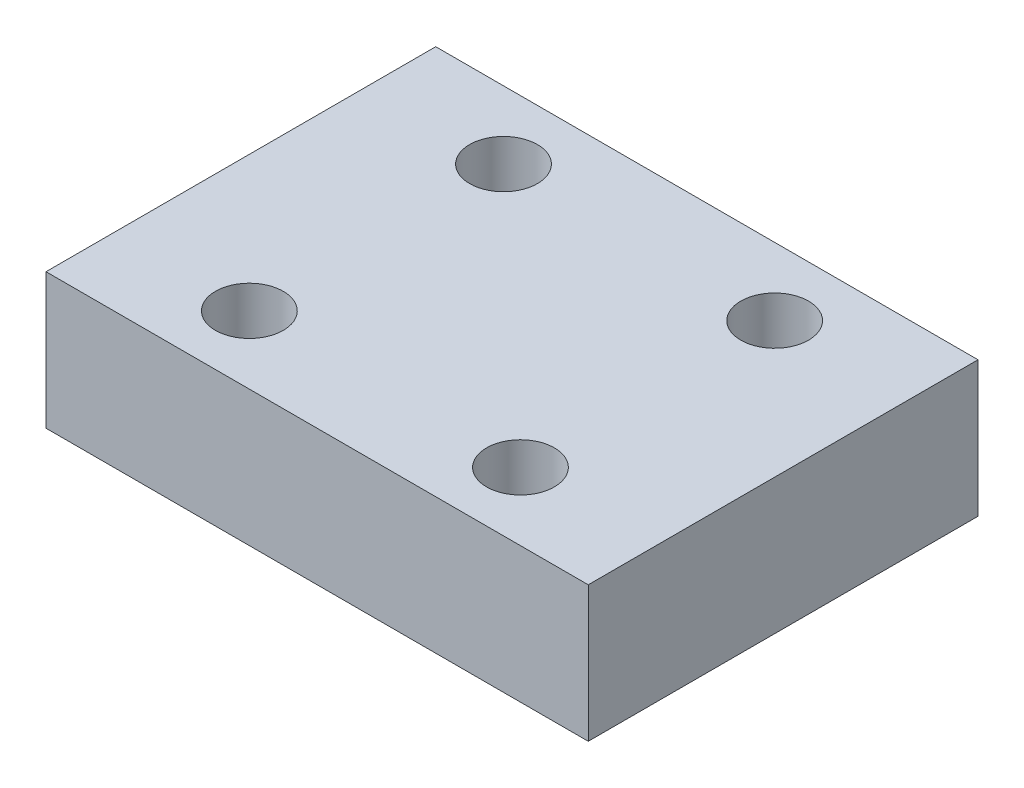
SolidWorks part; units mm, degrees
ref_plane "前视基准面" through (0, 0, 0) normal (0, 0, 1) x (1, 0, 0)
ref_plane "上视基准面" through (0, 0, 0) normal (0, 1, 0) x (1, 0, 0)
ref_plane "右视基准面" through (0, 0, 0) normal (1, 0, 0) x (0, 0, -1)
sketch "草图1" plane through (0, 0, 0) normal (0, 1, 0) x (1, 0, 0)
  line L1 (-18.5122, 7.3862) -> (13.4878, 7.3862)
  line L2 (-18.5122, 7.3862) -> (-18.5122, -15.6138)
  line L3 (-18.5122, -15.6138) -> (13.4878, -15.6138)
  line L4 (13.4878, 7.3862) -> (13.4878, -15.6138)
  circle A0 centre (-10.5122, 3.3862) radius 2
  circle A1 centre (5.4878, 3.3862) radius 2
  circle A2 centre (-10.5122, -11.6138) radius 2
  circle A3 centre (5.4878, -11.6138) radius 2
  dimension "D3" = 8
  dimension "D1" = 23
  dimension "D2" = 32
  dimension "D4" = 4
  dimension "D5" = 2
  dimension "D6" = 2
extrude "凸台-拉伸1" add sketch "草图1" along normal blind 8
